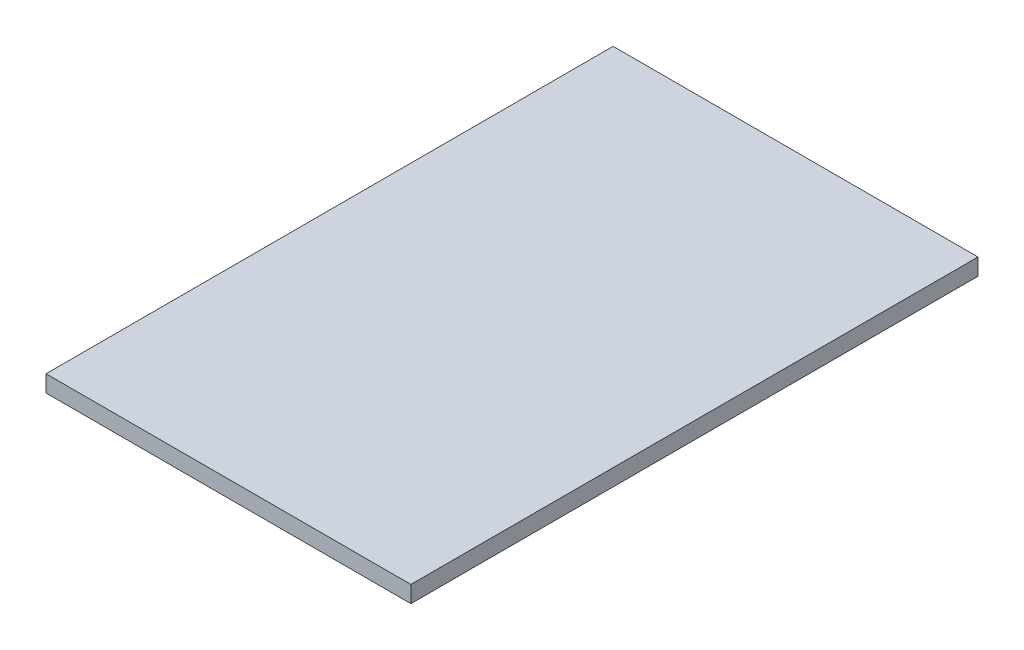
SolidWorks part; units mm, degrees
ref_plane "Front Plane" through (0, 0, 0) normal (0, 0, 1) x (1, 0, 0)
ref_plane "Top Plane" through (0, 0, 0) normal (0, 1, 0) x (1, 0, 0)
ref_plane "Right Plane" through (0, 0, 0) normal (1, 0, 0) x (0, 0, -1)
sketch "Sketch1" plane through (0, 0, 0) normal (0, 1, 0) x (1, 0, 0)
  line L1 (0, 0) -> (17.5, 0)
  line L2 (0, 0) -> (0, 27.2)
  line L3 (0, 27.2) -> (17.5, 27.2)
  line L4 (17.5, 0) -> (17.5, 27.2)
  dimension "D1" = 17.5
  dimension "D2" = 27.2
extrude "Boss-Extrude1" add sketch "Sketch1" along normal blind 0.8
